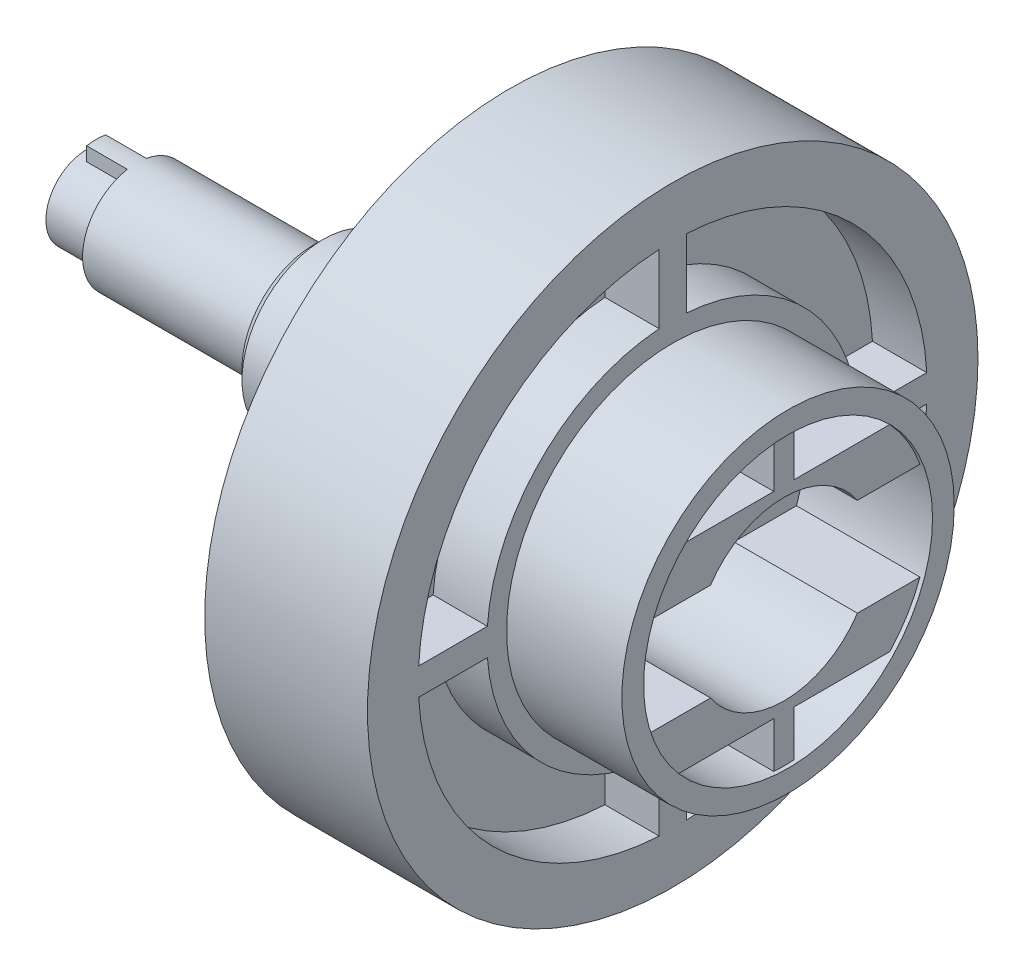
SolidWorks part; units mm, degrees
ref_plane "Plan1" through (0, 0, 0) normal (0, 0, 1) x (1, 0, 0)
ref_plane "Plan2" through (0, 0, 0) normal (0, 1, 0) x (1, 0, 0)
ref_plane "Plan3" through (0, 0, 0) normal (1, 0, 0) x (0, 0, -1)
sketch "Esquisse1" plane through (0, 0, 0) normal (0, 0, 1) x (1, 0, 0)
  line L0 (70, 0) -> (-30, 0) construction
  line L1 (51.4, 6.5) -> (51.4, 10.65)
  line L2 (0, 0) -> (8.7, 0)
  line L3 (8.7, 0) -> (8.7, 2.25)
  line L4 (8.7, 2.25) -> (19.8, 2.25)
  line L5 (19.8, 2.25) -> (19.8, 4.25)
  line L6 (19.8, 4.25) -> (29.4, 4.25)
  line L7 (29.4, 4.25) -> (29.4, 6.5)
  line L8 (29.4, 6.5) -> (51.4, 6.5)
  line L9 (51.4, 10.65) -> (51.7, 10.65)
  line L10 (51.7, 10.65) -> (51.7, 12.25)
  line L11 (51.7, 12.25) -> (43.2, 12.25)
  line L12 (43.2, 12.25) -> (43.2, 13.7)
  line L13 (43.2, 13.7) -> (39.2, 13.7)
  line L14 (39.2, 13.7) -> (39.2, 18.75)
  line L15 (43.2, 22.5) -> (31.2, 22.5)
  line L16 (31.2, 22.5) -> (31.2, 18.75)
  line L17 (31.2, 18.75) -> (35.2, 18.75)
  line L18 (35.2, 18.75) -> (35.2, 12)
  line L19 (39.2, 18.75) -> (43.2, 18.75)
  line L20 (43.2, 18.75) -> (43.2, 22.5)
  line L21 (35.2, 12) -> (39.2, 12)
  line L22 (39.2, 12) -> (39.2, 9.25)
  line L23 (39.2, 9.25) -> (26.45, 9.25)
  line L24 (26.45, 9.25) -> (25.7, 8.5)
  line L25 (25.7, 8.5) -> (25.7, 6)
  line L26 (0, 3) -> (0, 0)
  line L29 (16.7, 5.25) -> (16.7, 4)
  line L30 (16.7, 4) -> (3.7, 4)
  line L31 (3.7, 4) -> (3.7, 3)
  line L32 (25.7, 6) -> (17.45, 6)
  line L33 (17.45, 6) -> (16.7, 5.25)
  line L35 (3.7, 3) -> (0, 3)
  dimension "D1" = 8.7
  dimension "D2" = 2.25
  dimension "D3" = 3.7
  dimension "D4" = 2
  dimension "D5" = 9.6
  dimension "D6" = 2.25
  dimension "D7" = 4.15
  dimension "D8" = 0.3
  dimension "D9" = 1.6
  dimension "D10" = 8.5
  dimension "D11" = 1.45
  dimension "D12" = 4
  dimension "D13" = 5.05
  dimension "D14" = 22.5
  dimension "D15" = 12
  dimension "D16" = 6.75
  dimension "D17" = 4
  dimension "D18" = 2.75
  dimension "D19" = 12.75
  dimension "D20" = 45
  dimension "D21" = 0.75
  dimension "D22" = 2.5
  dimension "D24" = 22
  dimension "D25" = 11.1
  dimension "D26" = 1.25
  dimension "D27" = 8.25
  dimension "D29" = 1
revolve "Base-Révolution" add sketch "Esquisse1" angle 360 about L0
sketch "Esquisse3" plane through (51.4, 0, 0) normal (1, 0, 0) x (0, 0, -1)
  line L0 (0, 19.4928) -> (0, -17.378) construction
  line L1 (21.4697, 0) -> (-28.0899, 0) construction
  line L2 (-0.75, 10.6236) -> (-0.75, 7.25)
  line L3 (-0.75, 7.25) -> (-7.8013, 7.25)
  line L4 (10.0231, 3.6) -> (-10.0231, 3.6)
  line L5 (10.0231, -3.6) -> (-10.0231, -3.6)
  line L6 (0.75, 7.25) -> (7.8013, 7.25)
  line L7 (0.75, 10.6236) -> (0.75, 7.25)
  line L8 (-0.75, -7.25) -> (-7.8013, -7.25)
  line L9 (-0.75, -10.6236) -> (-0.75, -7.25)
  line L10 (0.75, -7.25) -> (7.8013, -7.25)
  line L11 (0.75, -10.6236) -> (0.75, -7.25)
  arc A0 (-10.0231, 3.6) -> (-10.0231, -3.6) centre (0, 0) ccw
  arc A1 (-7.8013, -7.25) -> (-0.75, -10.6236) centre (0, 0) ccw
  arc A2 (7.8013, 7.25) -> (0.75, 10.6236) centre (0, 0) ccw
  arc A3 (-0.75, 10.6236) -> (-7.8013, 7.25) centre (0, 0) ccw
  arc A4 (10.0231, -3.6) -> (10.0231, 3.6) centre (0, 0) ccw
  arc A5 (0.75, -10.6236) -> (7.8013, -7.25) centre (0, 0) ccw
  dimension "D1" = 21.3
  dimension "D2" = 0.75
  dimension "D3" = 7.25
  dimension "D4" = 3.6
  dimension "D5" = 3.6
extrude "Enlèv. mat.-Extru.1" cut sketch "Esquisse3" against normal blind 9.1
sketch "Esquisse6" plane through (0, 0, 0) normal (-1, 0, 0) x (0, 0, 1)
  line L0 (0, 16.2747) -> (0, -13.884) construction
  line L1 (-3, 16.2747) -> (-3, -12.5048)
  line L2 (-3, 16.2747) -> (-10.1602, 16.2747)
  line L3 (-10.1602, 16.2747) -> (-10.1602, -12.5048)
  line L4 (-10.1602, -12.5048) -> (-3, -12.5048)
  dimension "D1" = 3
extrude "Enlèv. mat.-Extru.4" cut sketch "Esquisse6" against normal blind 16.7
sketch "Esquisse7" plane through (3.7, 0, 0) normal (-1, 0, 0) x (0, 0, 1)
  line L0 (-0.7, 3.9383) -> (-0.7, 2.9172)
  line L1 (0, 15.631) -> (0, -15.2633) construction
  line L2 (0.7, 3.9383) -> (0.7, 2.9172)
  line L3 (-0.7, -2.9172) -> (-0.7, -3.9383)
  line L4 (0.7, -2.9172) -> (0.7, -3.9383)
  arc A0 (0.7, 3.9383) -> (-0.7, 3.9383) centre (0, 0) ccw
  arc A1 (0.7, 2.9172) -> (-0.7, 2.9172) centre (0, 0) ccw
  arc A3 (-0.7, -2.9172) -> (0.7, -2.9172) centre (0, 0) ccw
  arc A4 (-0.7, -3.9383) -> (0.7, -3.9383) centre (0, 0) ccw
  dimension "D1" = 8
  dimension "D3" = 6
  dimension "D2" = 0.7
  dimension "D4" = 0.7
extrude "Boss.-Extru.1" add sketch "Esquisse7" along normal blind 3
sketch "Esquisse8" plane through (0, 0, 0) normal (0, 0, 1) x (1, 0, 0)
  line L0 (43.2, 18.7573) -> (43.2, 13.5163)
  line L1 (43.2, -22.5) -> (43.2, 22.5) construction
rib "Nervure1" sketch "Esquisse8" sketch "Esquisse8" thickness 2 extrusion direction parallel to sketch draft on no parameters "D1"=2
pattern_circular "Répétition circulaire3" count 4 every 270 about axis through (70, 0, 0) along (-1, 0, 0)
sketch "Esquisse10" plane through (0, 0, 0) normal (0, 0, 1) x (1, 0, 0)
  line L0 (31.2, 18.6653) -> (31.2, 9.2867)
  line L1 (31.2, 22.5) -> (31.2, -22.5) construction
rib "Nervure3" sketch "Esquisse10" sketch "Esquisse10" thickness 2 extrusion direction parallel to sketch draft on no parameters "D1"=2
pattern_circular "Répétition circulaire4" count 4 every 270
